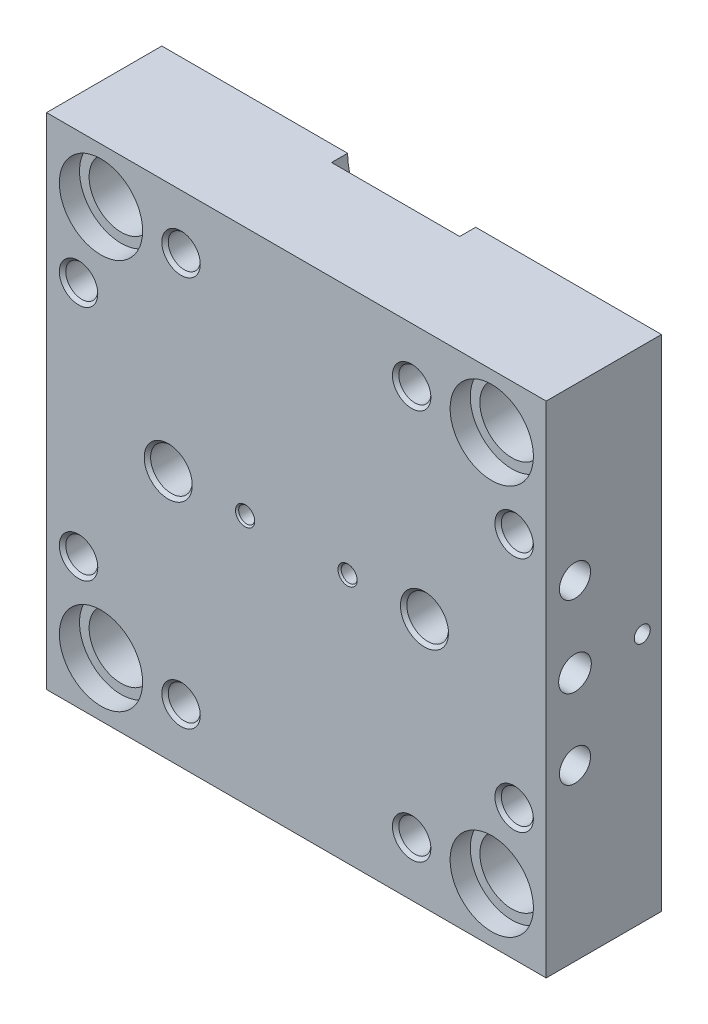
SolidWorks part; units mm, degrees
ref_plane "Plan de face" through (0, 0, 0) normal (0, 0, 1) x (1, 0, 0)
ref_plane "Plan de dessus" through (0, 0, 0) normal (0, 1, 0) x (1, 0, 0)
ref_plane "Plan de droite" through (0, 0, 0) normal (1, 0, 0) x (0, 0, -1)
sketch "Esquisse1" plane through (0, 0, 0) normal (0, 0, 1) x (1, 0, 0)
  line L1 (-78, 78) -> (78, 78)
  line L2 (-78, 78) -> (-78, -78)
  line L3 (-78, -78) -> (78, -78)
  line L4 (78, 78) -> (78, -78)
  point P4 (0, 78)
  point P6 (-78, 0)
  dimension "D1" = 156
  dimension "D2" = 156
extrude "Extrusion1" add sketch "Esquisse1" along normal blind 36
sketch "Esquisse2" plane through (0, 0, 0) normal (0, 0, 1) x (1, 0, 0)
  circle A0 centre (-61, 61) radius 10
  dimension "D1" = 20
  dimension "D3" = 61
  dimension "D2" = 61
extrude "Enlèv. mat.-Extru.2" cut sketch "Esquisse2" along normal through all
sketch "Esquisse3" plane through (0, 0, 36) normal (0, 0, 1) x (1, 0, 0)
  circle A0 centre (-61, 61) radius 13
  dimension "D1" = 26
extrude "Enlèv. mat.-Extru.3" cut sketch "Esquisse3" against normal blind 6.3
hole_wizard "Trou taraudé M10x1.51" positions "Esquisse7" profile "Esquisse6" tap size "M10x1.5" standard "Ansi Métrique"
sketch "Esquisse7" plane through (0, 0, 36) normal (0, 0, 1) x (1, 0, 0)
  point P0 (-36, 61)
  dimension "D1" = 61
  dimension "D2" = 36
sketch "Esquisse6" plane through (-36, 61, 36) normal (1, 0, 0) x (0, -1, 0)
  line L0 (0, 0) -> (0, 22.5537)
  line L1 (0, 22.5537) -> (4.25, 20)
  line L2 (4.25, 20) -> (4.25, 15)
  line L3 (4.25, 15) -> (5, 15)
  line L4 (5, 15) -> (5, 0)
  line L5 (5, 0) -> (0, 0)
  line L10 (0, 22.5537) -> (-4.25, 20) construction
  line L11 (0, -6.35) -> (0, 107.95) construction
  dimension "Diamètre du trou pour taraudage" = 8.5
  dimension "Profondeur du trou pour taraudage" = 20
  dimension "Diamètre principal du filetage" = 10
  dimension "Profondeur du filetage" = 15
  dimension "Angle de pointe" = 118
mirror "Symétrie1" about plane through (0, 0, 0) normal (1, 0, 0) of "Enlèv. mat.-Extru.3", "Enlèv. mat.-Extru.2", "Trou taraudé M10x1.51"
mirror "Symétrie2" about plane through (0, 0, 0) normal (0, 1, 0) of "Symétrie1", "Enlèv. mat.-Extru.2", "Enlèv. mat.-Extru.3", "Trou taraudé M10x1.51"
sketch "Esquisse8" plane through (0, 0, 0) normal (0, 0, -1) x (-1, 0, 0)
  line L0 (0, 0) -> (-19.3743, 0) construction
  line L1 (-20, 2.5) -> (20, 2.5)
  line L3 (-20, -2.5) -> (20, -2.5)
  arc A0 (20, 2.5) -> (20, -2.5) centre (20, 0) cw
  arc A1 (-20, 2.5) -> (-20, -2.5) centre (-20, 0) ccw
  point P4 (0, 2.5)
  dimension "D1" = 40
  dimension "D2" = 5
extrude "canal d'injection" cut sketch "Esquisse8" against normal blind 4
fillet "Congé1" radius 2.5 4 edges at (0, 2.5, 4) (-22.5, 0, 4) (0, -2.5, 4) (22.5, 0, 4)
sketch "Esquisse9" plane through (0, 0, 0) normal (0, 0, -1) x (-1, 0, 0)
  line L0 (-78, 78) -> (78, 78) construction
  line L1 (78, -78) -> (-78, -78) construction
  line L2 (-20, 78) -> (20, 78)
  line L3 (-20, -78) -> (20, -78)
  arc A0 (-20, 78) -> (20, 78) centre (0, 78) ccw
  arc A1 (20, -78) -> (-20, -78) centre (0, -78) ccw
  dimension "D1" = 20
  dimension "D2" = 20
extrude "passage pinces" cut sketch "Esquisse9" against normal blind 5
sketch "Esquisse10" plane through (0, 0, 0) normal (0, 0, -1) x (-1, 0, 0)
  line L0 (-20, 0) -> (20, 0) construction
  line L1 (0, 78) -> (0, -78) construction
  line L2 (20, 78) -> (-20, 78) construction
  line L3 (-20, -78) -> (20, -78) construction
  line L5 (78, 78) -> (78, -78) construction
  line L6 (78, 0) -> (-78, 0) construction
  line L7 (-78, -78) -> (-78, 78) construction
  circle A0 centre (-40, 0) radius 6.5
  circle A1 centre (-68, 37) radius 5
  circle A4 centre (40, 0) radius 6.5
  circle A5 centre (68, 37) radius 5
  circle A6 centre (68, -37) radius 5
  circle A7 centre (-68, -37) radius 5
  circle A9 centre (-16, 0) radius 2
  circle A10 centre (16, 0) radius 2
  dimension "D2" = 40
  dimension "D3" = 10
  dimension "D4" = 68
  dimension "D5" = 16
  dimension "D6" = 13
  dimension "D7" = 13
  dimension "D11" = 40
  dimension "D12" = 37
  dimension "D17" = 4
  dimension "D13" = 136
  dimension "D16" = 16
  dimension "D14" = 74
extrude "Enlèv. mat.-Extru.6" cut sketch "Esquisse10" against normal through all
sketch "Esquisse12" plane through (0, 0, 0) normal (0, 0, -1) x (-1, 0, 0)
  circle A0 centre (40, 0) radius 16
  circle A1 centre (-40, 0) radius 16
  dimension "D1" = 32
extrude "Enlèv. mat.-Extru.10" cut sketch "Esquisse12" against normal blind 20
hole_wizard "Trou taraudé M6x1.01" positions "Esquisse14" profile "Esquisse13" tap size "M6x1.0" standard "Ansi Métrique"
sketch "Esquisse14" plane through (-78, 0, 0) normal (-1, 0, 0) x (0, 0, 1)
  line L0 (0, 78) -> (0, -78) construction
  point P0 (6, 0)
  dimension "D1" = 6
sketch "Esquisse13" plane through (-78, 0, 6) normal (0, 1, 0) x (0, 0, 1)
  line L0 (0, 0) -> (0, 60)
  line L1 (0, 60) -> (2.5, 60)
  line L2 (2.5, 60) -> (2.5, 0)
  line L5 (2.5, 0) -> (0, 0)
  line L11 (0, -6.35) -> (0, 107.95) construction
  dimension "Diamètre du trou pour taraudage jusqu'au prochain" = 5
  dimension "Profondeur du trou pour taraudage jusqu'au prochain" = 60
hole_wizard "Trou taraudé M12x1.751" positions "Esquisse16" profile "Esquisse15" tap size "M12x1.75" standard "Ansi Metric"
sketch "Esquisse16" plane through (78, 0, 0) normal (1, 0, 0) x (0, 0, -1)
  line L0 (0, -78) -> (0, 78) construction
  point P0 (-27, 0)
  dimension "D1" = 27
sketch "Esquisse15" plane through (78, 0, 27) normal (0, 1, 0) x (0, 0, -1)
  line L0 (0, 0) -> (0, 28.0644)
  line L1 (0, 28.0644) -> (5.1, 25)
  line L2 (5.1, 25) -> (5.1, 0)
  line L5 (5.1, 0) -> (0, 0)
  line L10 (0, 28.0644) -> (-5.1, 25) construction
  line L11 (0, -6.35) -> (0, 107.95) construction
  dimension "Diamètre du trou pour taraudage" = 10.2
  dimension "Profondeur du trou pour taraudage" = 25
  dimension "Angle de pointe" = 118
hole_wizard "Trou taraudé 1/8 Rc1" positions "Esquisse18" profile "Esquisse17" size "1/8" standard "ISO"
sketch "Esquisse18" plane through (-78, 0, 0) normal (-1, 0, 0) x (0, 0, 1)
  line L0 (0, 78) -> (0, -78) construction
  point P0 (27, 25)
  point P2 (27, -25)
  point P5 (0, 0)
  dimension "D1" = 50
  dimension "D2" = 25
  dimension "D3" = 27
sketch "Esquisse17" plane through (-78, 25, 27) normal (0, 1, 0) x (0, 0, 1)
  line L0 (0, 0) -> (0, 14.3134)
  line L1 (3.95, 11.94) -> (0, 14.3134)
  line L2 (-3.95, 11.94) -> (0, 14.3134) construction
  line L3 (3.95, 11.94) -> (3.95, 7.4)
  line L4 (3.95, 7.4) -> (4.633, 7.4)
  line L5 (4.633, 7.4) -> (4.864, 0)
  line L6 (-4.633, 7.4) -> (-4.864, 0) construction
  line L7 (4.864, 0) -> (0, 0)
  line L8 (0, -6.35) -> (0, 107.95) construction
  line L11 (-3.95, 7.4) -> (-4.633, 7.4) construction
  dimension "Diamètre du trou pour taraudage" = 7.9
  dimension "Profondeur du trou pour taraudage" = 11.94
  dimension "Diamètre du filetage" = 9.728
  dimension "Angle de filetage" = 3.576
  dimension "Profondeur du filetage" = 7.4
  dimension "Angle de pointe" = 118
mirror "Symétrie3" about plane through (0, 0, 0) normal (1, 0, 0) of "Trou taraudé 1/8 Rc1"
sketch "Esquisse19" plane through (-78, 0, 0) normal (-1, 0, 0) x (0, 0, 1)
  circle A0 centre (27, 25) radius 3.5
  circle A1 centre (27, -25) radius 3.5
  dimension "D1" = 7
extrude "Enlèv. mat.-Extru.11" cut sketch "Esquisse19" against normal through all
mirror "Symétrie4" about plane through (0, 0, 0) normal (1, 0, 0) of "Trou taraudé M6x1.01"
sketch "Esquisse20" plane through (0, 0, 0) normal (0, 1, 0) x (1, 0, 0)
  line L0 (-16, 0) -> (-16, -42.3966) construction
  line L1 (20, 0) -> (-20, 0) construction
  line L2 (-18, -4) -> (-18, -36) construction
  line L3 (-14, -36) -> (-14, -4) construction
  line L4 (-18.25, 0) -> (-18.5907, -6.5)
  line L5 (-18.5907, -6.5) -> (-16, -6.5)
  line L6 (-16, -6.5) -> (-16, 0)
  line L7 (-16, 0) -> (-18.25, 0)
  line L8 (-18, -4) -> (-20, -4) construction
  dimension "D1" = 4.5
  dimension "D2" = 3
  dimension "D3" = 2.5
revolve "Enlèvement de matière-Révolution1" cut sketch "Esquisse20" angle 360 about L0
mirror "Symétrie5" about plane through (0, 0, 0) normal (1, 0, 0) of "Enlèvement de matière-Révolution1"
chamfer "Chanfrein1" distance 1 angle 45 12 edges at (-18, 0, 36) (14, 0, 36) (-46.5, 0, 36) (33.5, 0, 36) (-31, -61, 36) (41, -61, 36) (-31, 61, 36) (41, 61, 36) (63, -37, 36) (-73, -37, 36) (-73, 37, 36) (63, 37, 36)
sketch "Esquisse21" plane through (0, 0, 36) normal (0, 0, 1) x (1, 0, 0)
  circle A0 centre (16, 0) radius 2.5
  circle A1 centre (-16, 0) radius 2.5
  dimension "D1" = 5
extrude "Enlèv. mat.-Extru.12" cut sketch "Esquisse21" against normal blind 20
